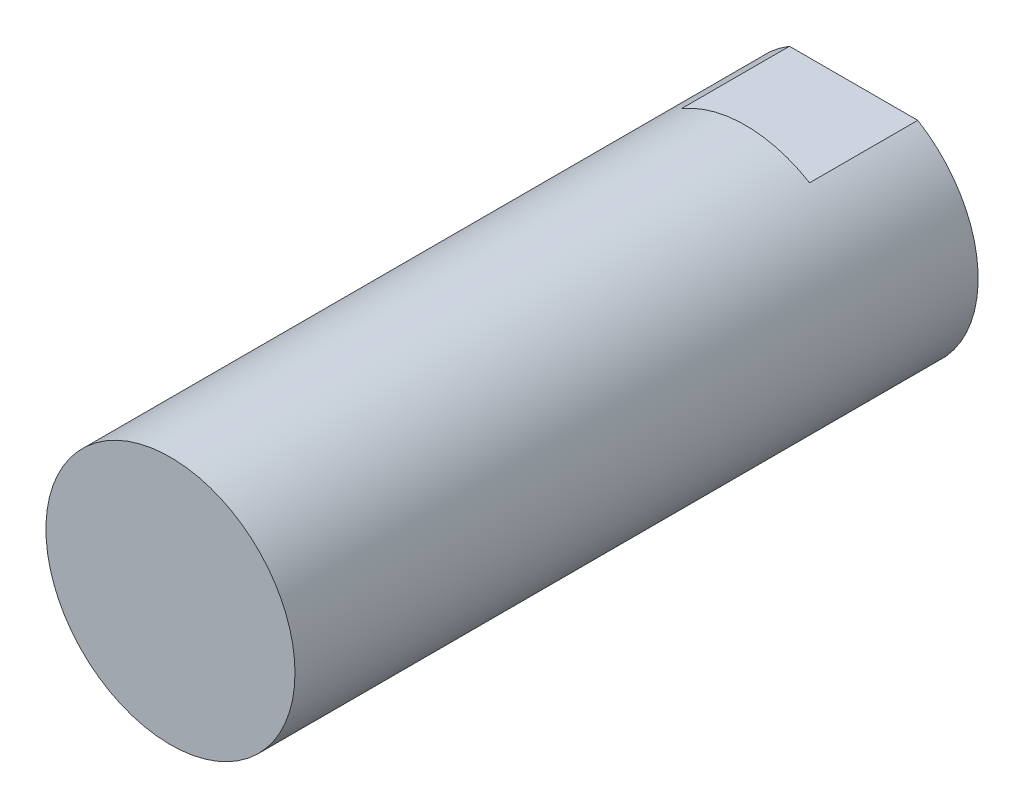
SolidWorks part; units mm, degrees
ref_plane "Front Plane" through (0, 0, 0) normal (0, 0, 1) x (1, 0, 0)
ref_plane "Top Plane" through (0, 0, 0) normal (0, 1, 0) x (1, 0, 0)
ref_plane "Right Plane" through (0, 0, 0) normal (1, 0, 0) x (0, 0, -1)
sketch "Sketch1" plane through (0, 0, 0) normal (0, 0, 1) x (1, 0, 0)
  circle A0 centre (0, 0) radius 11.1125
extrude "Extrude1" add sketch "Sketch1" along normal blind 22.86
sketch "Sketch2" plane through (0, 0, 22.86) normal (0, 0, 1) x (1, 0, 0)
  circle A0 centre (0, 0) radius 5.5562
extrude "Cut-Extrude1" cut sketch "Sketch2" against normal blind 10.922
sketch "Sketch3" plane through (0, 0, 0) normal (0, 0, -1) x (-1, 0, 0)
  circle A0 centre (0, 0) radius 3.9688
extrude "Cut-Extrude2" cut sketch "Sketch3" against normal through all
chamfer "Chamfer1" distance 1.016 angle 60 1 edges at (5.5562, 0, 22.86)
sketch "Sketch4" plane through (0, 0, 0) normal (0, 0, -1) x (-1, 0, 0)
  line L1 (0, 9.525) -> (13.4237, 9.525)
  line L2 (13.4237, 9.525) -> (13.4237, -9.525)
  line L3 (13.4237, -9.525) -> (-12.2796, -9.525)
  line L4 (-12.2796, -9.525) -> (-12.2796, 9.525)
  line L5 (-12.2796, 9.525) -> (0, 9.525)
  dimension "D1" = 9.525
  dimension "D2" = 9.525
extrude "Cut-Extrude3" cut sketch "Sketch4" against normal blind 9.652 flip side to cut
sketch "Sketch5" plane through (0, 0, 22.86) normal (0, 0, 1) x (1, 0, 0)
  circle A0 centre (0, 0) radius 11.1125
extrude "Extrude2" add sketch "Sketch5" along normal blind 38.1
